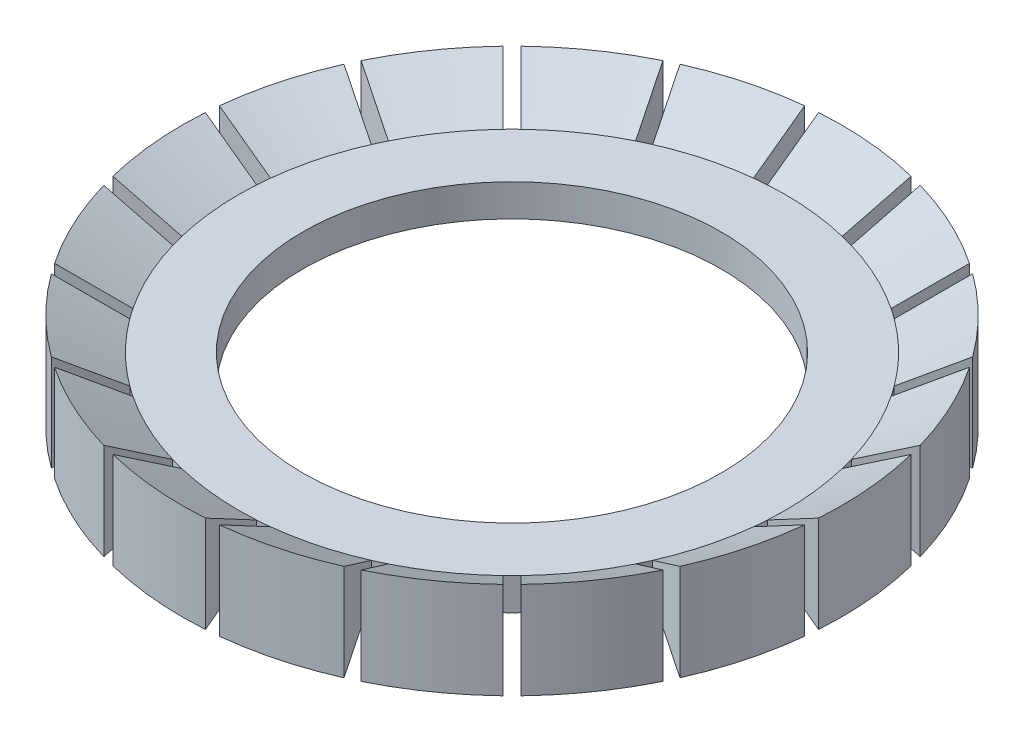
SolidWorks part; units mm, degrees
ref_plane "Plan de face" through (0, 0, 0) normal (0, 0, 1) x (1, 0, 0)
ref_plane "Plan de dessus" through (0, 0, 0) normal (0, 1, 0) x (1, 0, 0)
ref_plane "Plan de droite" through (0, 0, 0) normal (1, 0, 0) x (0, 0, -1)
imported_body "Importée3"
ref_plane "Plan1" through (0, 0, 0) normal (0, 0, -1) x (-1, 0, 0)
sketch "Esquisse1" plane through (0, 0, 0) normal (0, 0, -1) x (-1, 0, 0)
  line L0 (-6.5, -0.5) -> (0, -0.5)
  line L1 (0, -0.5) -> (0, 0.5)
  line L2 (0, 0.5) -> (-6.5, 0.5)
  line L3 (-6.5, 0.5) -> (-6.5, -0.5)
  line L4 (0, -0.5) -> (0, 0.5) construction
revolve "Enlèvement de matière-Révolution1" cut sketch "Esquisse1" angle 360 about L4
